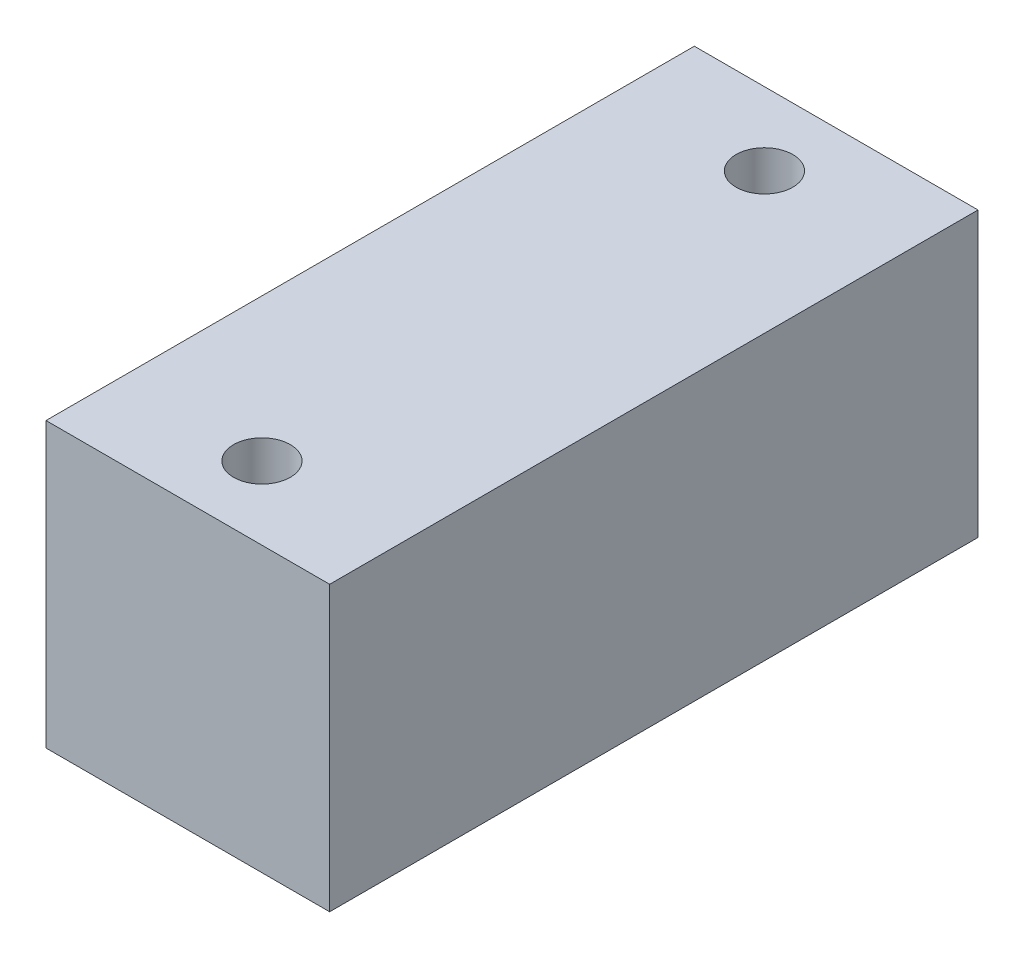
SolidWorks part; units mm, degrees
ref_plane "Plan1" through (0, 0, 0) normal (0, 0, 1) x (1, 0, 0)
ref_plane "Plan2" through (0, 0, 0) normal (0, 1, 0) x (1, 0, 0)
ref_plane "Plan3" through (0, 0, 0) normal (1, 0, 0) x (0, 0, -1)
sketch "Esquisse1" plane through (0, 0, 0) normal (0, 0, 1) x (1, 0, 0)
  line L1 (0, 0) -> (35, 0)
  line L2 (0, 0) -> (0, 35)
  line L3 (0, 35) -> (35, 35)
  line L4 (35, 0) -> (35, 35)
  dimension "D1" = 35
  dimension "D2" = 35
extrude "Base-Extrusion" add sketch "Esquisse1" along normal blind 80
sketch "Esquisse2" plane through (0, 35, 0) normal (0, 1, 0) x (-1, 0, 0)
  circle A0 centre (-17.6455, 9) radius 3.5
  circle A1 centre (-17.6455, 71) radius 3.5
  dimension "D1" = 7
  dimension "D2" = 7
  dimension "D3" = 62
  dimension "D4" = 9
extrude "Enlèv. mat.-Extru.1" cut sketch "Esquisse2" against normal through all
